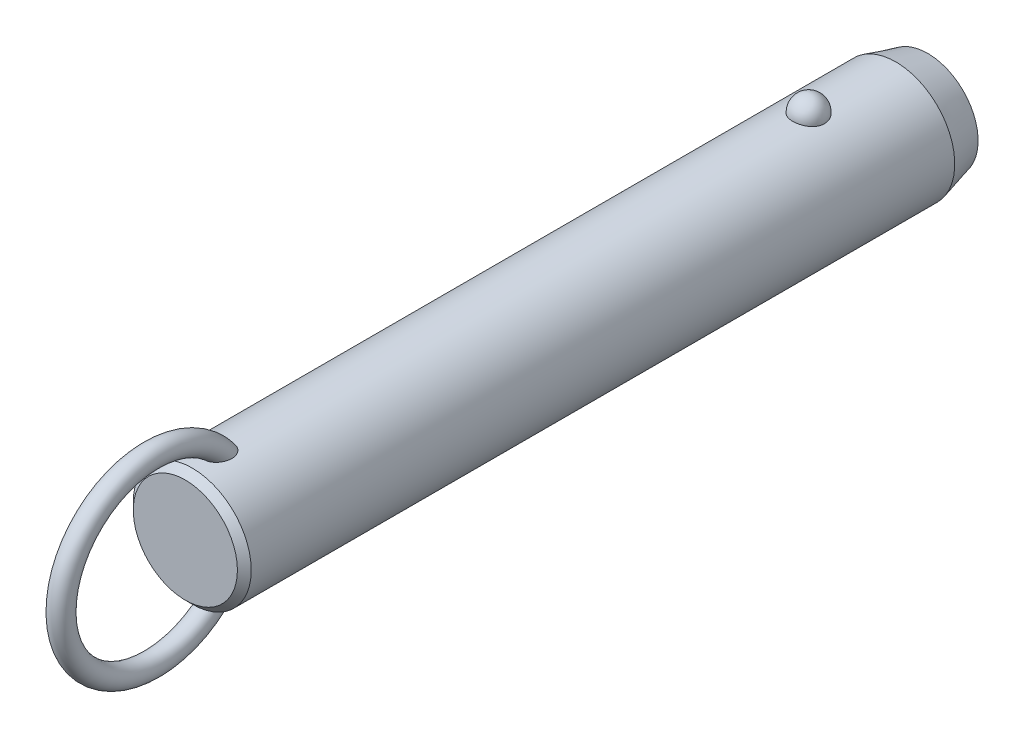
SolidWorks part; units mm, degrees
ref_plane "Front Plane" through (0, 0, 0) normal (0, 0, 1) x (1, 0, 0)
ref_plane "Top Plane" through (0, 0, 0) normal (0, 1, 0) x (1, 0, 0)
ref_plane "Right Plane" through (0, 0, 0) normal (1, 0, 0) x (0, 0, -1)
sketch "Sketch2" plane through (0, 0, 0) normal (0, 0, 1) x (1, 0, 0)
  circle A0 centre (0, 0) radius 11.1
  point P3 (0, 11.1)
  dimension "D1" = 22.2
extrude "Boss-Extrude1" add sketch "Sketch2" along normal blind 101.6
sketch "Sketch3" plane through (0, 0, 0) normal (0, 0, -1) x (-1, 0, 0)
  circle A0 centre (0, 0) radius 11.1
  dimension "D1" = 22.2
extrude "Boss-Extrude2" add sketch "Sketch3" along normal blind 25.4
chamfer "Chamfer1" distance 6 angle 15 1 edges at (-11.1, 0, -25.4)
sketch "Sketch12" plane through (0, 0, 0) normal (1, 0, 0) x (0, 0, -1)
  line L0 (-101.6, 11.1) -> (-101.6, -11.1) construction
  point P0 (-101.6, 0)
sketch "Sketch13" plane through (0, 0, 0) normal (1, 0, 0) x (0, 0, -1)
  circle A0 centre (-120.65, 0) radius 19.05
  point P2 (-101.6, 0)
  dimension "D1" = 38.1
sketch "Sketch14" plane through (0, 0, 0) normal (0, 1, 0) x (1, 0, 0)
  circle A0 centre (0, -103.6) radius 2
  point P2 (0, -101.6)
  dimension "D1" = 4
sweep "Sweep1" add profiles "Sketch14" path "Sketch13"
sketch "Sketch15" plane through (0, 0, 101.6) normal (0, 0, 1) x (1, 0, 0)
  circle A0 centre (0, 0) radius 11.1
  dimension "D1" = 22.2
extrude "Boss-Extrude3" add sketch "Sketch15" along normal blind 12.7
chamfer "Chamfer2" distance 1.3 angle 45 1 edges at (11.1, 0, 114.3)
sketch "Sketch18" plane through (0, 0, 0) normal (1, 0, 0) x (0, 0, -1)
  line L0 (19.4, 11.1) -> (-105.168, 11.1) construction
  line L1 (3, 14.1) -> (3, 8.1)
  line L2 (-105.168, -11.1) -> (19.4, -11.1) construction
  arc A0 (3, 14.1) -> (3, 8.1) centre (3, 11.1) ccw
  point P4 (0, 11.1)
  dimension "D1" = 25.2
revolve "Revolve1" add sketch "Sketch18" angle 360 about L1
